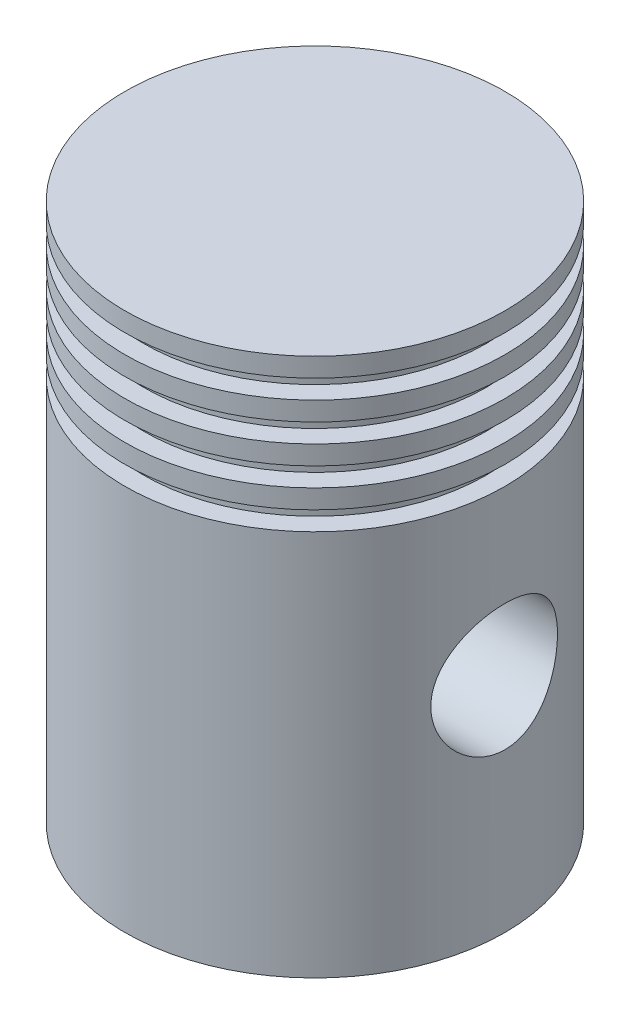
SolidWorks part; units mm, degrees
ref_plane "Front Plane" through (0, 0, 0) normal (0, 0, 1) x (1, 0, 0)
ref_plane "Top Plane" through (0, 0, 0) normal (0, 1, 0) x (1, 0, 0)
ref_plane "Right Plane" through (0, 0, 0) normal (1, 0, 0) x (0, 0, -1)
sketch "Sketch1" plane through (0, 0, 0) normal (0, 0, 1) x (1, 0, 0)
  line L0 (0, -1952.066) -> (0, 95651.2355) construction
  line L2 (0, 85) -> (30, 85)
  line L3 (30, 85) -> (30, 82)
  line L4 (30, 82) -> (27, 82)
  line L5 (27, 82) -> (27, 79)
  line L6 (27, 79) -> (30, 79)
  line L7 (30, 79) -> (30, 76)
  line L8 (30, 76) -> (27, 76)
  line L9 (27, 76) -> (27, 73)
  line L10 (27, 73) -> (30, 73)
  line L11 (30, 73) -> (30, 70)
  line L12 (30, 70) -> (27, 70)
  line L13 (27, 70) -> (27, 67)
  line L14 (27, 67) -> (30, 67)
  line L15 (30, 67) -> (30, 64)
  line L16 (30, 64) -> (27, 64)
  line L17 (30, 0) -> (24, 0)
  line L18 (24, 0) -> (24, 73)
  line L19 (24, 73) -> (0, 73)
  line L20 (0, 73) -> (0, 85)
  line L22 (27, 64) -> (27, 61)
  line L23 (27, 61) -> (30, 61)
  line L24 (30, 61) -> (30, 0)
  point P22 (0, 0)
  point P27 (0, 0)
  point P28 (0, 0)
  dimension "D1" = 85
  dimension "D2" = 3
  dimension "D3" = 12
  dimension "D4" = 48
  dimension "D5" = 60
revolve "Revolve1" add sketch "Sketch1" angle 360 about L0
sketch "Sketch2" plane through (0, 0, 0) normal (1, 0, 0) x (0, 0, -1)
  line L0 (0, 61) -> (0, 0) construction
  line L1 (-30, 0) -> (30, 0) construction
  circle A0 centre (0, 35) radius 13
  dimension "D1" = 26
  dimension "D3" = 35
extrude "Boss-Extrude2" add sketch "Sketch2" along normal up to next and the other way up to next
sketch "Sketch3" plane through (0, 0, 0) normal (1, 0, 0) x (0, 0, -1)
  line L0 (0, 61) -> (0, 0) construction
  circle A0 centre (0, 35) radius 10
  dimension "D1" = 35
  dimension "D2" = 20
extrude "Cut-Extrude1" cut sketch "Sketch3" against normal through all both and the other way through all
sketch "Sketch4" plane through (0, 0, 0) normal (0, 1, 0) x (1, 0, 0)
  line L1 (-10, -13) -> (10, -13)
  line L2 (-10, -13) -> (-10, 13)
  line L3 (-10, 13) -> (10, 13)
  line L4 (10, -13) -> (10, 13)
  point P4 (0, 13)
  point P5 (-10, 0)
  dimension "D1" = 20
  dimension "D2" = 26
extrude "Cut-Extrude2" cut sketch "Sketch4" along normal blind 50 and the other way through all
